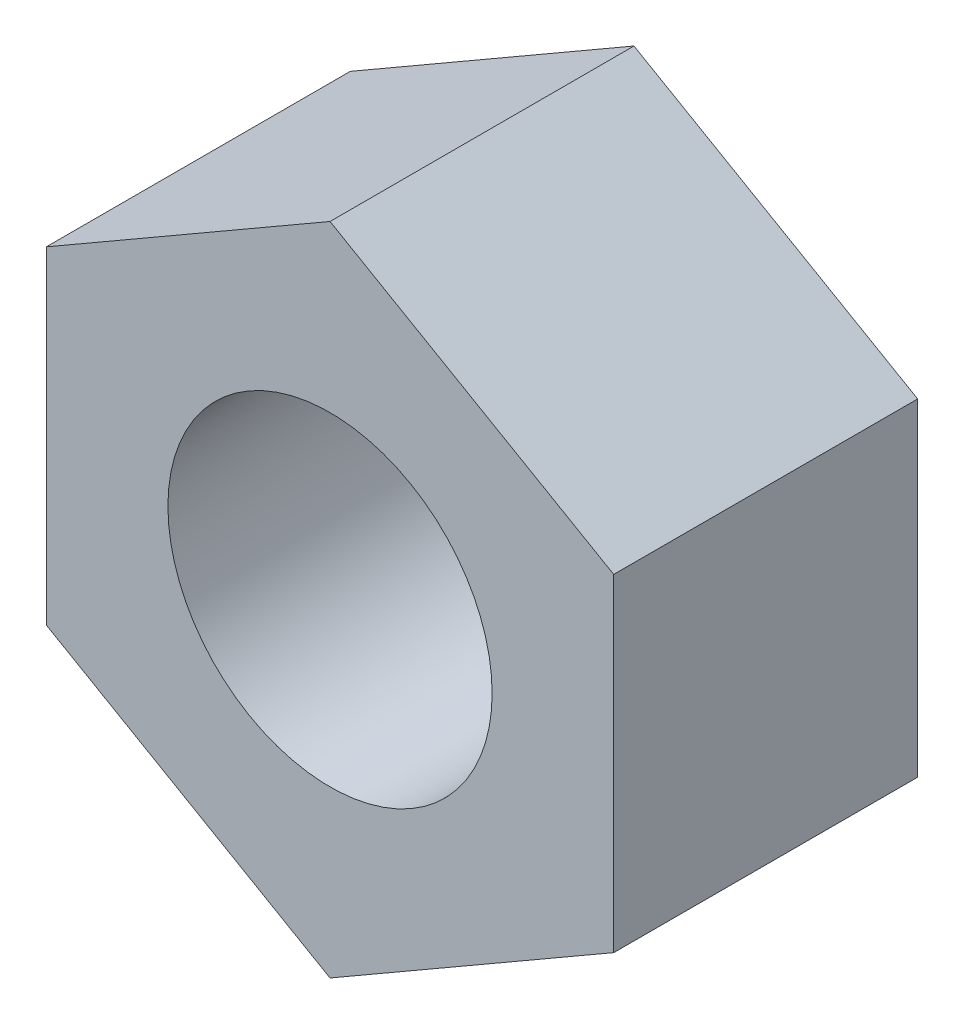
SolidWorks part; units mm, degrees
ref_plane "Front Plane" through (0, 0, 0) normal (0, 0, 1) x (1, 0, 0)
ref_plane "Top Plane" through (0, 0, 0) normal (0, 1, 0) x (1, 0, 0)
ref_plane "Right Plane" through (0, 0, 0) normal (1, 0, 0) x (0, 0, -1)
sketch "Sketch1" plane through (0, 0, 0) normal (0, 0, 1) x (1, 0, 0)
  line L1 (14, 8.0829) -> (0, 16.1658)
  line L2 (0, 16.1658) -> (-14, 8.0829)
  line L3 (-14, 8.0829) -> (-14, -8.0829)
  line L4 (-14, -8.0829) -> (0, -16.1658)
  line L5 (0, -16.1658) -> (14, -8.0829)
  line L6 (14, -8.0829) -> (14, 8.0829)
  circle A0 centre (0, 0) radius 14 construction
  dimension "D1" = 28
extrude "Boss-Extrude1" add sketch "Sketch1" along normal blind 15
sketch "Sketch2" plane through (0, 0, 0) normal (0, 0, -1) x (-1, 0, 0)
  circle A0 centre (0, 0) radius 8
  dimension "D1" = 16
extrude "Cut-Extrude1" cut sketch "Sketch2" against normal through all contours A0
